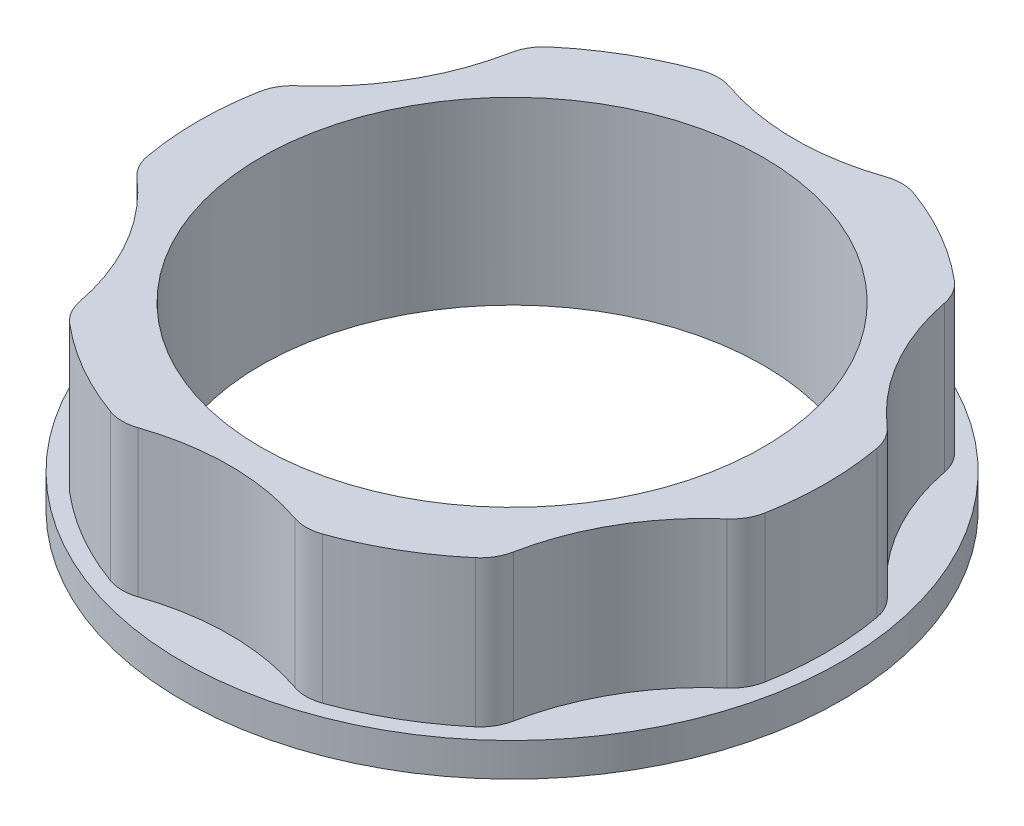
SolidWorks part; units mm, degrees
ref_plane "Plan de face" through (0, 0, 0) normal (0, 0, 1) x (1, 0, 0)
ref_plane "Plan de dessus" through (0, 0, 0) normal (0, 1, 0) x (1, 0, 0)
ref_plane "Plan de droite" through (0, 0, 0) normal (1, 0, 0) x (0, 0, -1)
sketch "Esquisse1" plane through (0, 0, 0) normal (0, 1, 0) x (1, 0, 0)
  line L0 (0, 25) -> (0, 0) construction
  circle A0 centre (0, 0) radius 12
  arc A1 (-5.0697, 14.1173) -> (-9.6911, 11.4491) centre (0, 0) ccw
  arc A2 (-3.7428, 14.1261) -> (3.7428, 14.1261) centre (0, 25) ccw
  arc A3 (10.3622, 10.3044) -> (14.105, 3.8217) centre (21.6506, 12.5) ccw
  arc A4 (14.105, -3.8217) -> (10.3622, -10.3044) centre (21.6506, -12.5) ccw
  arc A5 (3.7428, -14.1261) -> (-3.7428, -14.1261) centre (0, -25) ccw
  arc A6 (-10.3622, -10.3044) -> (-14.105, -3.8217) centre (-21.6506, -12.5) ccw
  arc A7 (-14.105, 3.8217) -> (-10.3622, 10.3044) centre (-21.6506, 12.5) ccw
  arc A8 (9.6911, 11.4491) -> (5.0697, 14.1173) centre (0, 0) ccw
  arc A9 (14.7608, -2.6682) -> (14.7608, 2.6682) centre (0, 0) ccw
  arc A10 (5.0697, -14.1173) -> (9.6911, -11.4491) centre (0, 0) ccw
  arc A11 (-9.6911, -11.4491) -> (-5.0697, -14.1173) centre (0, 0) ccw
  arc A12 (-14.7608, 2.6682) -> (-14.7608, -2.6682) centre (0, 0) ccw
  arc A13 (-3.7428, 14.1261) -> (-5.0697, 14.1173) centre (-4.3937, 12.235) ccw
  arc A14 (-10.3622, 10.3044) -> (-9.6911, 11.4491) centre (-8.399, 9.9226) cw
  arc A15 (-14.105, 3.8217) -> (-14.7608, 2.6682) centre (-12.7927, 2.3124) ccw
  arc A16 (-14.105, -3.8217) -> (-14.7608, -2.6682) centre (-12.7927, -2.3124) cw
  arc A17 (-10.3622, -10.3044) -> (-9.6911, -11.4491) centre (-8.399, -9.9226) ccw
  arc A18 (-3.7428, -14.1261) -> (-5.0697, -14.1173) centre (-4.3937, -12.235) cw
  arc A19 (3.7428, -14.1261) -> (5.0697, -14.1173) centre (4.3937, -12.235) ccw
  arc A20 (10.3622, -10.3044) -> (9.6911, -11.4491) centre (8.399, -9.9226) cw
  arc A21 (14.105, -3.8217) -> (14.7608, -2.6682) centre (12.7927, -2.3124) ccw
  arc A22 (14.105, 3.8217) -> (14.7608, 2.6682) centre (12.7927, 2.3124) cw
  arc A23 (10.3622, 10.3044) -> (9.6911, 11.4491) centre (8.399, 9.9226) ccw
  arc A24 (3.7428, 14.1261) -> (5.0697, 14.1173) centre (4.3937, 12.235) cw
  point P23 (0, 0)
  dimension "D1" = 6
  dimension "D2" = 2
extrude "Boss.-Extru.1" add sketch "Esquisse1" along normal blind 7
sketch "Esquisse2" plane through (0, 0, 0) normal (0, -1, 0) x (1, 0, 0)
  circle A0 centre (0, 0) radius 12
  circle A1 centre (0, 0) radius 15.75
extrude "Boss.-Extru.2" add sketch "Esquisse2" along normal blind 1.6
